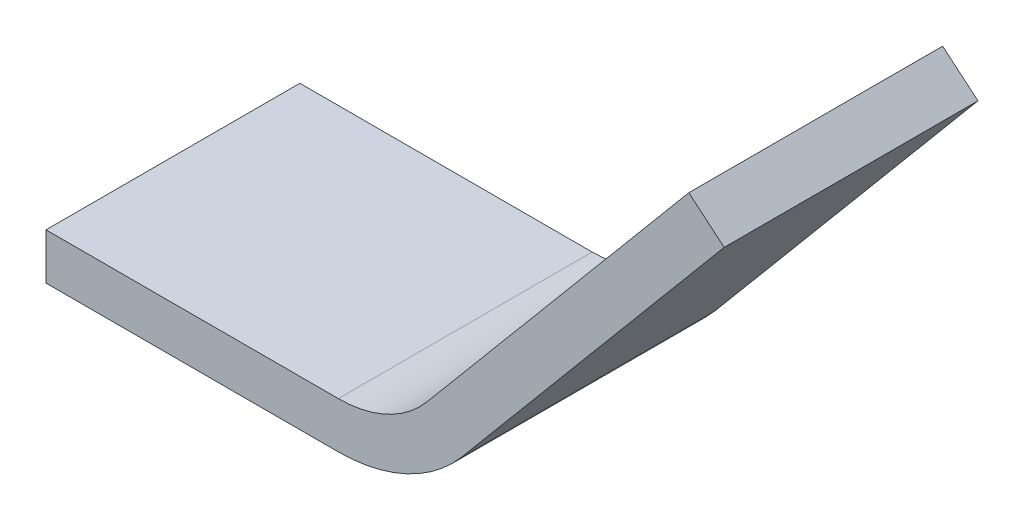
SolidWorks part; units mm, degrees
ref_plane "Plan de face" through (0, 0, 0) normal (0, 0, 1) x (1, 0, 0)
ref_plane "Plan de dessus" through (0, 0, 0) normal (0, 1, 0) x (1, 0, 0)
ref_plane "Plan de droite" through (0, 0, 0) normal (1, 0, 0) x (0, 0, -1)
sketch "Esquisse1" plane through (0, 0, 0) normal (0, 0, 1) x (1, 0, 0)
  line L0 (-0.4663, 0) -> (-3, 0)
  line L1 (0.2997, 0.3572) -> (2.5712, 3.0642)
  arc A0 (-0.4663, 0) -> (0.2997, 0.3572) centre (-0.4663, 1) ccw
  point P5 (0, 0)
  point P7 (0, 0)
  dimension "D4" = 1
  dimension "D1" = 50
  dimension "D2" = 4
  dimension "D3" = 3
extrude "Extru.-Mince1" add sketch "Esquisse1" along normal blind 2.2 thin
